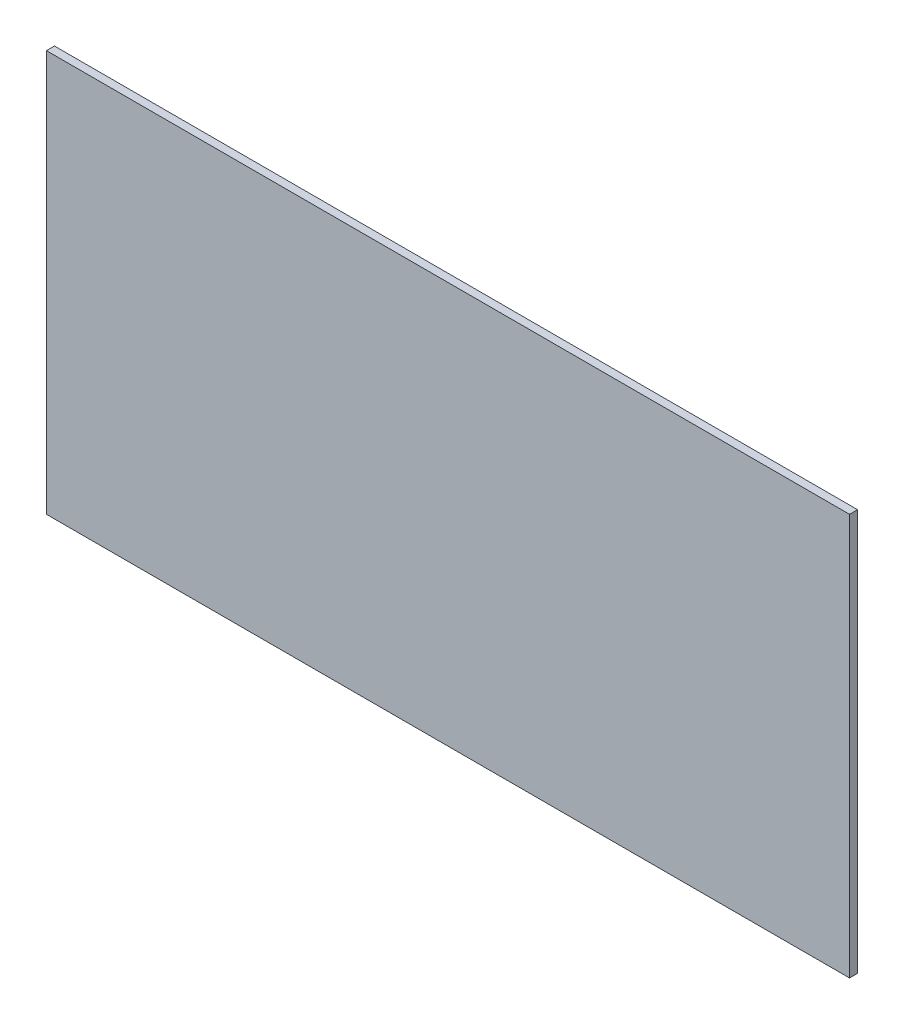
SolidWorks part; units mm, degrees
ref_plane "Ebene vorne" through (0, 0, 0) normal (0, 0, 1) x (1, 0, 0)
ref_plane "Ebene oben" through (0, 0, 0) normal (0, 1, 0) x (1, 0, 0)
ref_plane "Ebene rechts" through (0, 0, 0) normal (1, 0, 0) x (0, 0, -1)
sketch "Skizze1" plane through (0, 0, 0) normal (0, 0, 1) x (1, 0, 0)
  line L1 (0, 0) -> (200, 0)
  line L2 (0, 0) -> (0, 100)
  line L3 (0, 100) -> (200, 100)
  line L4 (200, 0) -> (200, 100)
  dimension "D1" = 100
  dimension "D2" = 200
extrude "Linear austragen1" add sketch "Skizze1" along normal blind 2
sketch "Skizze2" plane through (0, 0, 2) normal (0, 0, 1) x (1, 0, 0)
  line L0 (0, 26.9149) -> (200, 26.9149) construction
  line L1 (0, 100) -> (0, 0) construction
  line L2 (200, 0) -> (200, 100) construction
